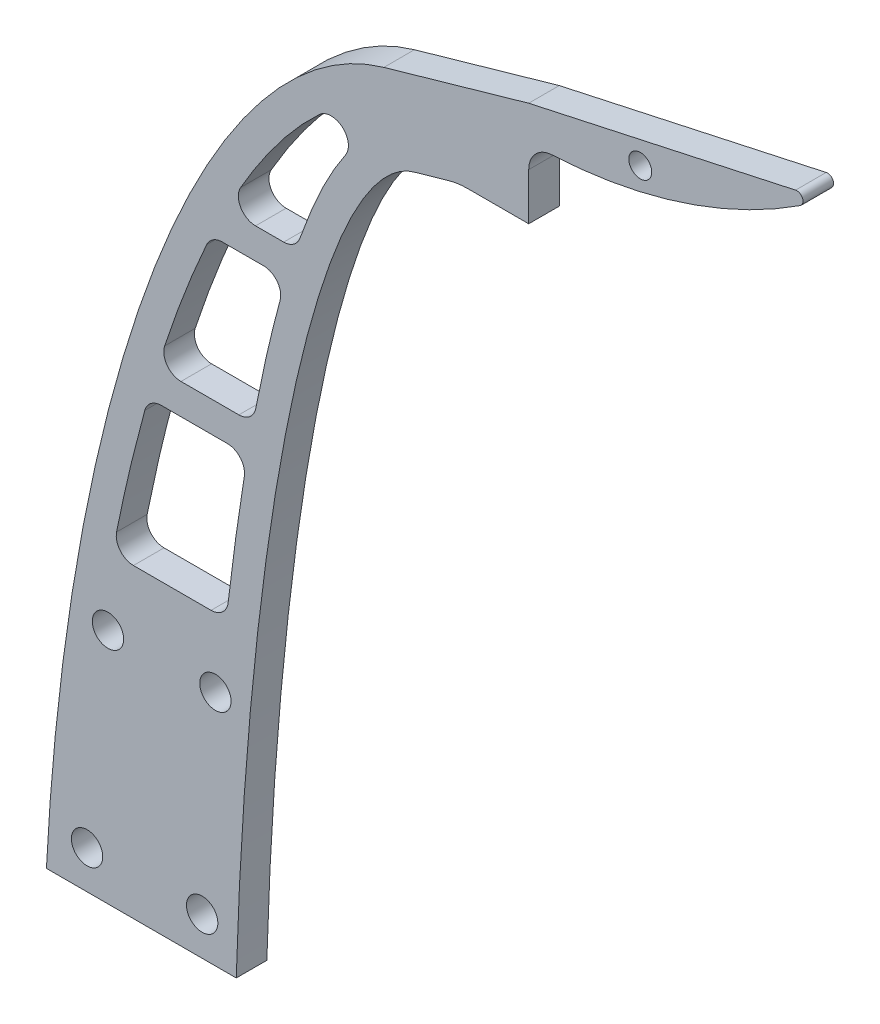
SolidWorks part; units mm, degrees
ref_plane "Plan de face" through (0, 0, 0) normal (0, 0, 1) x (1, 0, 0)
ref_plane "Plan de dessus" through (0, 0, 0) normal (0, 1, 0) x (1, 0, 0)
ref_plane "Plan de droite" through (0, 0, 0) normal (1, 0, 0) x (0, 0, -1)
sketch "Esquisse1" plane through (0, 0, 0) normal (0, 0, 1) x (1, 0, 0)
  line L0 (-0.7395, 9.26) -> (-0.7395, 0)
  line L1 (-0.7395, 0) -> (-8.7395, 0)
  line L2 (-11.212, -0.3463) -> (-15.725, -1.6357)
  line L3 (-0.7395, 13.66) -> (-19.6827, 8.2476)
  line L4 (89.2605, -120.251) -> (-60.7622, -160.4495) construction
  line L5 (89.2605, -120.251) -> (-87.485, -120.251) construction
  line L6 (-86.1521, -200) -> (170.4283, -200) construction
  line L7 (89.2605, -183.0726) -> (89.2605, -200) construction
  line L8 (-0.7395, 13.66) -> (38.0779, 22.1236)
  line L9 (-0.7395, 13.66) -> (-0.7395, 74.26) construction
  line L10 (89.2605, -200) -> (89.2605, -216.9274) construction
  line L11 (101.2572, -177.7054) -> (109.2605, -207.5742)
  arc A2 (-8.7395, 0) -> (-11.212, -0.3463) centre (-8.7395, -9) ccw
  arc A8 (-0.7395, 9.26) -> (38.0779, 22.1236) centre (-0.7395, 74.26) ccw
  ellipse E0 centre (-14.2395, -121.4237) end of major axis (-14.2395, -1.4237) minor radius 25 (-15.725, -1.6357) -> (-34.1467, -194.014) ccw
  ellipse E1 centre (-14.2395, -121.4237) end of major axis (-14.2395, 9.0229) minor radius 50 (-19.6827, 8.2476) -> (-52.4262, -205.6311) ccw
  ellipse E3 centre (45.7938, -131.8979) end of major axis (-80.047, -165.6168) minor radius 94.5 (-52.4262, -205.6311) -> (109.2605, -207.5742) ccw
  ellipse E4 centre (45.7938, -131.8979) end of major axis (161.7049, -100.8396) minor radius 62.5 (-34.1467, -194.014) -> (101.2572, -177.7054) ccw
  point P15 (-10, 0)
  dimension "D3" = 240
  dimension "D9" = 65
  dimension "D10" = 60.6
  dimension "D13" = 13.5
  dimension "D14" = 15
  dimension "D15" = 125
  dimension "D16" = 9
  dimension "D19" = 200
  dimension "D18" = 260.56
  dimension "D4" = 90
  dimension "D5" = 32
  dimension "D6" = 13.66
  dimension "D7" = 8
  dimension "D8" = 102.3
  dimension "D11" = 50
  dimension "D12" = 25
  dimension "D17" = 240
  dimension "D20" = 45
  dimension "D21" = 20
extrude "Boss.-Extru.1" add sketch "Esquisse1" along normal blind 4
fillet "Congé1" radius 3.2 1 edges at (-0.7395, 9.26, 2)
fillet "Congé2" radius 0.8 1 edges at (38.0779, 22.1236, 2)
sketch "Esquisse6" plane through (0, 0, 4) normal (0, 0, 1) x (1, 0, 0)
  line L0 (34.166, 21.2706) -> (-0.7395, 13.66) construction
  circle A0 centre (13.8526, 13.8888) radius 1.5
  arc A1 (34.7735, 19.8189) -> (34.166, 21.2706) centre (34.3364, 20.489) ccw construction
  dimension "D1" = 3
  dimension "D3" = 21.5209
  dimension "D2" = 2.8851
extrude "Enlèv. mat.-Extru.2" cut sketch "Esquisse6" against normal blind 4
fillet "Congé4" radius 40 1 edges at (-34.1467, -194.014, 2)
fillet "Congé5" radius 55 1 edges at (-52.4262, -205.6311, 2)
fillet "Congé6" radius 5 2 edges at (109.2605, -207.5742, 2) (101.2572, -177.7054, 2)
sketch "Esquisse7" plane through (0, 0, 4) normal (0, 0, 1) x (1, 0, 0)
  line L0 (-144.8031, -104.5541) -> (34.7735, -104.5541)
  line L1 (34.7735, 19.8189) -> (34.7735, -228.9271) construction
  arc A0 (34.7735, 19.8189) -> (34.166, 21.2706) centre (34.3364, 20.489) ccw construction
  arc A1 (2.3104, 9.3316) -> (34.7735, 19.8189) centre (-0.7395, 74.26) ccw construction
  ellipse E0 centre (45.7938, -131.8979) end of major axis (-80.047, -165.6168) minor radius 94.5 (-23.5509, -221.1552) -> (105.7042, -209.472) ccw construction
extrude "Enlèv. mat.-Extru.3" cut sketch "Esquisse7" against normal through all and the other way through all flip side to cut
hole_wizard "Diamètre du perçage Ø4.1 (4.1)1" positions "Esquisse9" profile "Esquisse8" hole size "Ø4.1" standard "ISO"
sketch "Esquisse9" plane through (0, 0, 4) normal (0, 0, 1) x (1, 0, 0)
  line L0 (-55.7704, -73.5541) -> (-41.719, -73.5541) construction
  line L3 (-58.5039, -99.5541) -> (-43.4487, -99.5541) construction
  line L6 (-59.9488, -68.5541) -> (-36.6823, -68.5541) construction
  line L9 (-38.9912, -104.5541) -> (-63.8196, -104.5541) construction
  line L10 (-48.3155, -68.5541) -> (-51.4054, -104.5541) construction
  ellipse E0 centre (-14.2395, -121.4237) end of major axis (-14.2395, 9.0229) minor radius 50 (-19.6827, 8.2476) -> (-63.8196, -104.5541) ccw construction
  ellipse E1 centre (-14.2395, -121.4237) end of major axis (-14.2395, -241.4237) minor radius 25 (-15.725, -1.6357) -> (-38.9912, -104.5541) ccw construction
  point P0 (-41.719, -73.5541)
  point P1 (-55.7704, -73.5541)
  point P3 (-58.5039, -99.5541)
  point P5 (-43.4487, -99.5541)
  dimension "D1" = 36
  dimension "D2" = 5
  dimension "D3" = 7.5
  dimension "D4" = 7.5
  dimension "D5" = 7
  dimension "D6" = 7
  dimension "D7" = 5
sketch "Esquisse8" plane through (-41.719, -73.5541, 4) normal (1, 0, 0) x (0, -1, 0)
  line L0 (0, 0) -> (0, 61.2318)
  line L1 (0, 61.2318) -> (2.05, 60)
  line L2 (2.05, 60) -> (2.05, 0)
  line L5 (2.05, 0) -> (0, 0)
  line L10 (0, 61.2318) -> (-2.05, 60) construction
  line L11 (0, -6.35) -> (0, 107.95) construction
  dimension "Diamètre du perçage" = 4.1
  dimension "Profondeur du perçage" = 60
  dimension "Angle de pointe" = 118
sketch "Esquisse10" plane through (0, 0, 4) normal (0, 0, 1) x (1, 0, 0)
  line L0 (-76.3872, -68.5541) -> (-16.0145, -68.5541) construction
  line L1 (-38.9912, -104.5541) -> (-63.8196, -104.5541) construction
  line L2 (-40.8088, -22.0956) -> (-35.4254, -22.0956)
  line L3 (-46.2198, -40.5956) -> (-38.6496, -40.5956)
  line L4 (-48.7858, -44.5956) -> (-40.1581, -44.5956)
  line L5 (-52.4391, -64.5541) -> (-42.2876, -64.5541)
  line L7 (-32.7856, -18.0956) -> (-36.4666, -18.0956)
  arc A0 (-24.7254, -4.2267) -> (-28.0943, -1.286) centre (-26.575, -2.9456) ccw
  arc A1 (-32.7856, -18.0956) -> (-30.6651, -16.5979) centre (-32.7856, -15.8456) ccw
  arc A2 (-36.4666, -18.0956) -> (-38.4147, -14.7197) centre (-36.4666, -15.8456) cw
  arc A3 (-46.2198, -40.5956) -> (-48.3568, -37.6414) centre (-46.2198, -38.3456) cw
  arc A4 (-38.6496, -40.5956) -> (-36.441, -38.7751) centre (-38.6496, -38.3456) ccw
  arc A5 (-33.2549, -24.9387) -> (-35.4254, -22.0956) centre (-35.4254, -24.3456) ccw
  arc A6 (-42.8576, -23.4156) -> (-40.8088, -22.0956) centre (-40.8088, -24.3456) cw
  arc A7 (-54.6454, -61.8628) -> (-52.4391, -64.5541) centre (-52.4391, -62.3041) ccw
  arc A8 (-42.2876, -64.5541) -> (-40.0526, -62.5635) centre (-42.2876, -62.3041) ccw
  arc A9 (-37.937, -47.2048) -> (-40.1581, -44.5956) centre (-40.1581, -46.8456) ccw
  arc A10 (-50.9547, -46.2468) -> (-48.7858, -44.5956) centre (-48.7858, -46.8456) cw
  spline S0 degree 3 poles (-705.7172, -2911.3563) (142.772, -133.6753) (15.2361, 18.1866) (-19.1145, 1.2641) (-19.6444, 0.9455) (-21.1645, -0.1207) (-22.086, -0.9761) (-23.8134, -2.924) (-24.6203, -4.0188) (-26.1646, -6.4456) (-26.9017, -7.7784) (-29.0375, -12.1373) (-30.3626, -15.5267) (-32.8509, -23.2382) (-34.0116, -27.5595) (-36.1544, -37.038) (-37.1358, -42.1947) (-38.8979, -53.2082) (-39.6784, -59.0647) (-41.0189, -71.3154) (-41.5788, -77.7094) (-57.6822, -317.0884) (74.4788, -773.2634) (550.5537, 2827.273) knots -1.872008 -1.872008 -1.872008 -1.872008 0.03125 0.03125 0.0625 0.0625 0.125 0.125 0.1875 0.1875 0.25 0.25 0.375 0.375 0.5 0.5 0.625 0.625 0.75 0.75 0.875 0.875 5.302884 5.302884 5.302884 5.302884 only from (-16.8239, 2.2104) to (-42.9895, -104.4358)
  spline S1 degree 3 poles (-24.7254, -4.2267) (-24.9509, -4.5523) (-25.1731, -4.8875) (-26.1646, -6.4456) (-26.9017, -7.7784) (-28.6841, -11.416) (-29.6987, -13.874) (-30.6651, -16.5979) knots 0.169743 0.169743 0.169743 0.169743 0.1875 0.1875 0.25 0.25 0.343975 0.343975 0.343975 0.343975
  spline S2 degree 3 poles (239.0927, 2989.0378) (63.1092, -831.1671) (72.6706, 51.1423) (-23.134, 2.4678) (-24.298, 1.7467) (-26.6424, 0.0171) (-27.8226, -0.9914) (-30.1797, -3.2979) (-31.3565, -4.5958) (-34.8539, -8.9147) (-37.1399, -12.3621) (-41.5008, -20.2902) (-43.5762, -24.7701) (-47.4312, -34.6222) (-49.211, -39.9942) (-52.4123, -51.4686) (-53.8339, -57.5708) (-56.2728, -70.3268) (-57.2901, -76.9805) (-85.6533, -319.4648) (145.9687, -768.858) (999.3093, 2672.7083) knots -5.086528 -5.086528 -5.086528 -5.086528 0.0625 0.0625 0.125 0.125 0.1875 0.1875 0.25 0.25 0.375 0.375 0.5 0.5 0.625 0.625 0.75 0.75 0.875 0.875 5.185545 5.185545 5.185545 5.185545 only from (-18.5838, 4.4015) to (-59.8246, -104.7538)
  spline S3 degree 3 poles (-28.0943, -1.286) (-28.3966, -1.5627) (-28.6989, -1.8489) (-30.1797, -3.2979) (-31.3565, -4.5958) (-34.5331, -8.5186) (-36.5101, -11.4244) (-38.4147, -14.7197) knots 0.171472 0.171472 0.171472 0.171472 0.1875 0.1875 0.25 0.25 0.357805 0.357805 0.357805 0.357805
  spline S4 degree 3 poles (-705.7172, -2911.3563) (142.772, -133.6753) (15.2361, 18.1866) (-19.1145, 1.2641) (-19.6444, 0.9455) (-21.1645, -0.1207) (-22.086, -0.9761) (-23.8134, -2.924) (-24.6203, -4.0188) (-26.1646, -6.4456) (-26.9017, -7.7784) (-29.0375, -12.1373) (-30.3626, -15.5267) (-32.8509, -23.2382) (-34.0116, -27.5595) (-36.1544, -37.038) (-37.1358, -42.1947) (-38.8979, -53.2082) (-39.6784, -59.0647) (-41.0189, -71.3154) (-41.5788, -77.7094) (-57.6822, -317.0884) (74.4788, -773.2634) (550.5537, 2827.273) knots -1.872008 -1.872008 -1.872008 -1.872008 0.03125 0.03125 0.0625 0.0625 0.125 0.125 0.1875 0.1875 0.25 0.25 0.375 0.375 0.5 0.5 0.625 0.625 0.75 0.75 0.875 0.875 5.302884 5.302884 5.302884 5.302884 only from (-16.8239, 2.2104) to (-42.9895, -104.4358)
  spline S5 degree 3 poles (-33.2549, -24.9387) (-33.8901, -27.2631) (-34.4998, -29.719) (-35.5533, -34.379) (-36.0062, -36.5397) (-36.441, -38.7751) knots 0.431958 0.431958 0.431958 0.431958 0.5 0.5 0.554868 0.554868 0.554868 0.554868
  spline S6 degree 3 poles (239.0927, 2989.0378) (63.1092, -831.1671) (72.6706, 51.1423) (-23.134, 2.4678) (-24.298, 1.7467) (-26.6424, 0.0171) (-27.8226, -0.9914) (-30.1797, -3.2979) (-31.3565, -4.5958) (-34.8539, -8.9147) (-37.1399, -12.3621) (-41.5008, -20.2902) (-43.5762, -24.7701) (-47.4312, -34.6222) (-49.211, -39.9942) (-52.4123, -51.4686) (-53.8339, -57.5708) (-56.2728, -70.3268) (-57.2901, -76.9805) (-85.6533, -319.4648) (145.9687, -768.858) (999.3093, 2672.7083) knots -5.086528 -5.086528 -5.086528 -5.086528 0.0625 0.0625 0.125 0.125 0.1875 0.1875 0.25 0.25 0.375 0.375 0.5 0.5 0.625 0.625 0.75 0.75 0.875 0.875 5.185545 5.185545 5.185545 5.185545 only from (-18.5838, 4.4015) to (-59.8246, -104.7538)
  spline S7 degree 3 poles (-42.8576, -23.4156) (-43.7662, -25.4175) (-44.6495, -27.513) (-46.4953, -32.2302) (-47.4477, -34.8823) (-48.3568, -37.6414) knots 0.444602 0.444602 0.444602 0.444602 0.5 0.5 0.564303 0.564303 0.564303 0.564303
  spline S8 degree 3 poles (239.0927, 2989.0378) (63.1092, -831.1671) (72.6706, 51.1423) (-23.134, 2.4678) (-24.298, 1.7467) (-26.6424, 0.0171) (-27.8226, -0.9914) (-30.1797, -3.2979) (-31.3565, -4.5958) (-34.8539, -8.9147) (-37.1399, -12.3621) (-41.5008, -20.2902) (-43.5762, -24.7701) (-47.4312, -34.6222) (-49.211, -39.9942) (-52.4123, -51.4686) (-53.8339, -57.5708) (-56.2728, -70.3268) (-57.2901, -76.9805) (-85.6533, -319.4648) (145.9687, -768.858) (999.3093, 2672.7083) knots -5.086528 -5.086528 -5.086528 -5.086528 0.0625 0.0625 0.125 0.125 0.1875 0.1875 0.25 0.25 0.375 0.375 0.5 0.5 0.625 0.625 0.75 0.75 0.875 0.875 5.185545 5.185545 5.185545 5.185545 only from (-18.5838, 4.4015) to (-59.8246, -104.7538)
  spline S9 degree 3 poles (-50.9547, -46.2468) (-52.3229, -51.2027) (-53.5581, -56.427) (-54.6454, -61.8628) knots 0.628736 0.628736 0.628736 0.628736 0.736307 0.736307 0.736307 0.736307
  spline S10 degree 3 poles (-705.7172, -2911.3563) (142.772, -133.6753) (15.2361, 18.1866) (-19.1145, 1.2641) (-19.6444, 0.9455) (-21.1645, -0.1207) (-22.086, -0.9761) (-23.8134, -2.924) (-24.6203, -4.0188) (-26.1646, -6.4456) (-26.9017, -7.7784) (-29.0375, -12.1373) (-30.3626, -15.5267) (-32.8509, -23.2382) (-34.0116, -27.5595) (-36.1544, -37.038) (-37.1358, -42.1947) (-38.8979, -53.2082) (-39.6784, -59.0647) (-41.0189, -71.3154) (-41.5788, -77.7094) (-57.6822, -317.0884) (74.4788, -773.2634) (550.5537, 2827.273) knots -1.872008 -1.872008 -1.872008 -1.872008 0.03125 0.03125 0.0625 0.0625 0.125 0.125 0.1875 0.1875 0.25 0.25 0.375 0.375 0.5 0.5 0.625 0.625 0.75 0.75 0.875 0.875 5.302884 5.302884 5.302884 5.302884 only from (-16.8239, 2.2104) to (-42.9895, -104.4358)
  spline S11 degree 3 poles (-37.937, -47.2048) (-37.9637, -47.37) (-37.9903, -47.5355) (-38.7712, -52.416) (-39.4518, -57.387) (-40.0526, -62.5635) knots 0.621235 0.621235 0.621235 0.621235 0.625 0.625 0.732018 0.732018 0.732018 0.732018
  point P4 (-76.3872, -63.3519)
  point P5 (-16.0145, -63.3519)
  dimension "D5" = 4.5
  dimension "D6" = 4
  dimension "D11" = 17.4
  dimension "D4" = 2.25
  dimension "D10" = 2.25
  dimension "D16" = 2.25
  dimension "D1" = 36
  dimension "D7" = 18.5
  dimension "D8" = 4
  dimension "D9" = 4
  dimension "D12" = 4
  dimension "D13" = 4
  dimension "D2" = 4
  dimension "D3" = 4
  dimension "D14" = 4
  dimension "D15" = 4
extrude "Enlèv. mat.-Extru.4" cut sketch "Esquisse10" against normal through all
